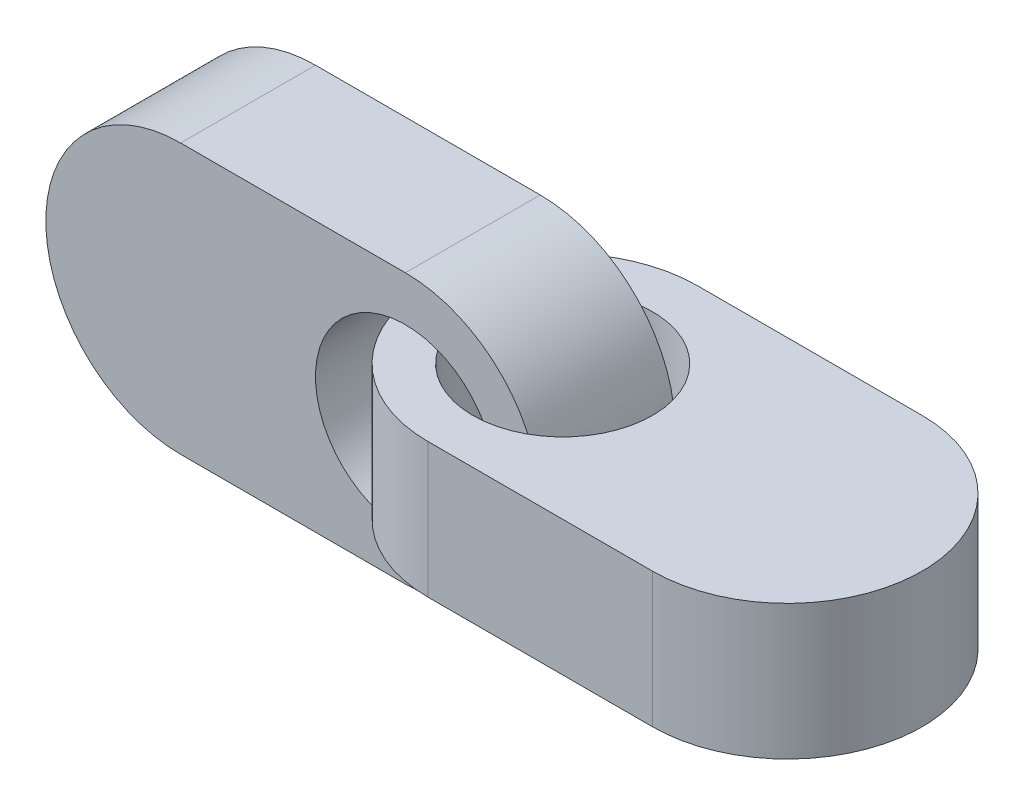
SolidWorks part; units mm, degrees
ref_plane "Alzado" through (0, 0, 0) normal (0, 0, 1) x (1, 0, 0)
ref_plane "Planta" through (0, 0, 0) normal (0, 1, 0) x (1, 0, 0)
ref_plane "Vista lateral" through (0, 0, 0) normal (1, 0, 0) x (0, 0, -1)
sketch "Sketch1" plane through (0, 0, 0) normal (0, 0, 1) x (1, 0, 0)
  line L0 (0, 0) -> (-5, 0) construction
  line L1 (0, -3) -> (-5, -3)
  line L2 (0, 3) -> (-5, 3)
  circle A0 centre (0, 0) radius 2
  arc A1 (0, -3) -> (0, 3) centre (0, 0) ccw
  arc A2 (-5, 3) -> (-5, -3) centre (-5, 0) ccw
  point P3 (-2.5, 0)
  dimension "D1" = 4
  dimension "D2" = 3
  dimension "D3" = 5
extrude "Boss-Extrude1" add sketch "Sketch1" along normal mid plane 3
sketch "Sketch2" plane through (0, 0, 0) normal (0, 1, 0) x (1, 0, 0)
  line L0 (2, 0) -> (7, 0) construction
  line L1 (2, 3) -> (7, 3)
  line L2 (2, -3) -> (7, -3)
  line L3 (0, -1.5) -> (0, 1.5) construction
  circle A0 centre (2, 0) radius 2
  arc A1 (2, 3) -> (2, -3) centre (2, 0) ccw
  arc A2 (7, -3) -> (7, 3) centre (7, 0) ccw
  point P2 (4.5, 0)
  dimension "D1" = 4
  dimension "D2" = 3
  dimension "D3" = 5
  dimension "D4" = 2
extrude "Boss-Extrude2" add sketch "Sketch2" along normal mid plane 3
